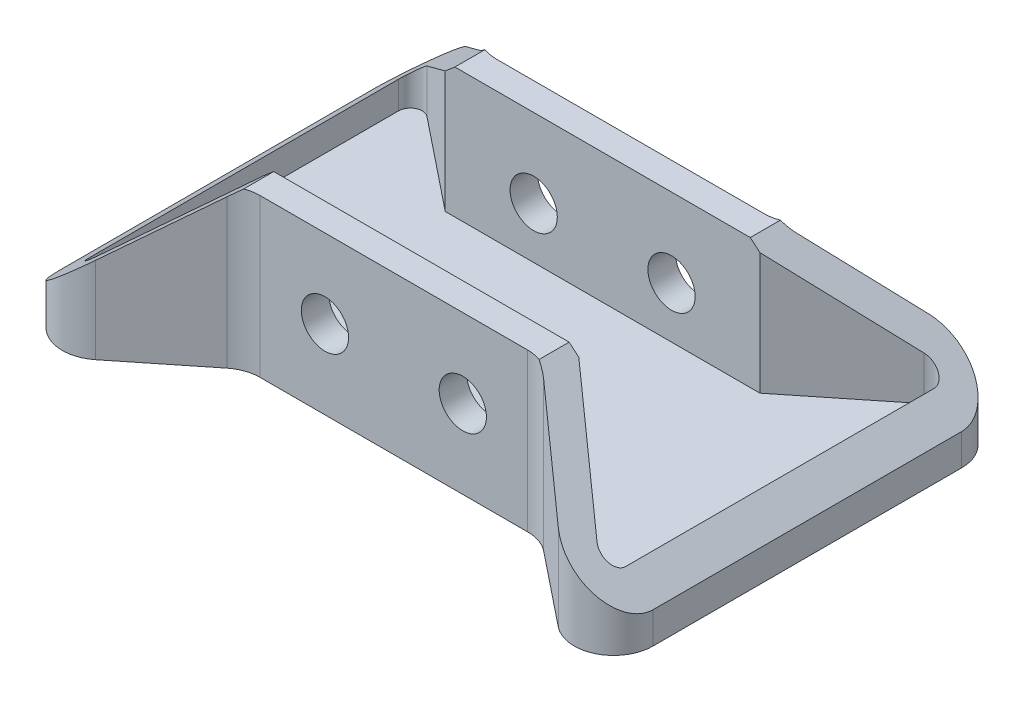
SolidWorks part; units mm, degrees
ref_plane "Front" through (0, 0, 0) normal (0, 0, 1) x (1, 0, 0)
ref_plane "Top" through (0, 0, 0) normal (0, 1, 0) x (1, 0, 0)
ref_plane "Right" through (0, 0, 0) normal (1, 0, 0) x (0, 0, -1)
sketch "Sketch1" plane through (0, 0, 0) normal (0, 1, 0) x (1, 0, 0)
  line L0 (37.5, 30) -> (58.753, 47.0024)
  line L1 (-37.5, -30) -> (37.5, -30)
  line L2 (-40.0352, 0) -> (54.6232, 0) construction
  line L3 (-37.5, 30) -> (37.5, 30)
  line L5 (-37.5, -30) -> (37.5, 30) construction
  line L6 (-37.5, 30) -> (37.5, -30) construction
  line L7 (-37.5, -30) -> (-58.753, -47.0024)
  line L8 (37.5, -30) -> (58.753, -47.0024)
  line L9 (-37.5, 30) -> (-58.753, 47.0024)
  line L10 (-75, 39.1938) -> (-75, -39.1938)
  line L11 (75, 39.1938) -> (75, -39.1938)
  arc A0 (58.753, -47.0024) -> (75, -39.1938) centre (65, -39.1938) ccw
  arc A1 (-58.753, -47.0024) -> (-75, -39.1938) centre (-65, -39.1938) cw
  arc A2 (58.753, 47.0024) -> (75, 39.1938) centre (65, 39.1938) cw
  arc A3 (-58.753, 47.0024) -> (-75, 39.1938) centre (-65, 39.1938) ccw
  point P0 (0, 0)
  point P20 (75, -60)
  point P23 (-75, -60)
  point P26 (75, 60)
  point P29 (-75, 60)
  dimension "D4" = 10
  dimension "D1" = 60
  dimension "D2" = 120
  dimension "D3" = 150
extrude "Boss-Extrude1" add sketch "Sketch1" along normal blind 40
sketch "Sketch2" plane through (0, 0, 0) normal (0, 0, 1) x (1, 0, 0)
  line L0 (37.5, 40) -> (75, 8)
  line L1 (75, 40) -> (75, 0) construction
  line L2 (75, 40) -> (58.753, 40) construction
  dimension "D1" = 32
extrude "Cut-Extrude1" cut sketch "Sketch2" against normal through all both and the other way through all
mirror "Mirror1" about plane through (0, 0, 0) normal (1, 0, 0) of "Cut-Extrude1"
shell "Shell1" thickness 7
sketch "Sketch3" plane through (0, 0, 30) normal (0, 0, 1) x (1, 0, 0)
  line L0 (0, 0) -> (0, 53.1272) construction
  line L1 (-37.5, 0) -> (37.5, 0) construction
  circle A0 centre (-17.5, 20) radius 6
  circle A1 centre (17.5, 20) radius 6
  dimension "D1" = 12
  dimension "D2" = 12
  dimension "D3" = 35
  dimension "D4" = 20
extrude "Cut-Extrude2" cut sketch "Sketch3" against normal through all
fillet "Fillet1" radius 10 4 edges at (-37.5, 20, -30) (37.5, 20, -30) (37.5, 20, 30) (-37.5, 20, 30)
